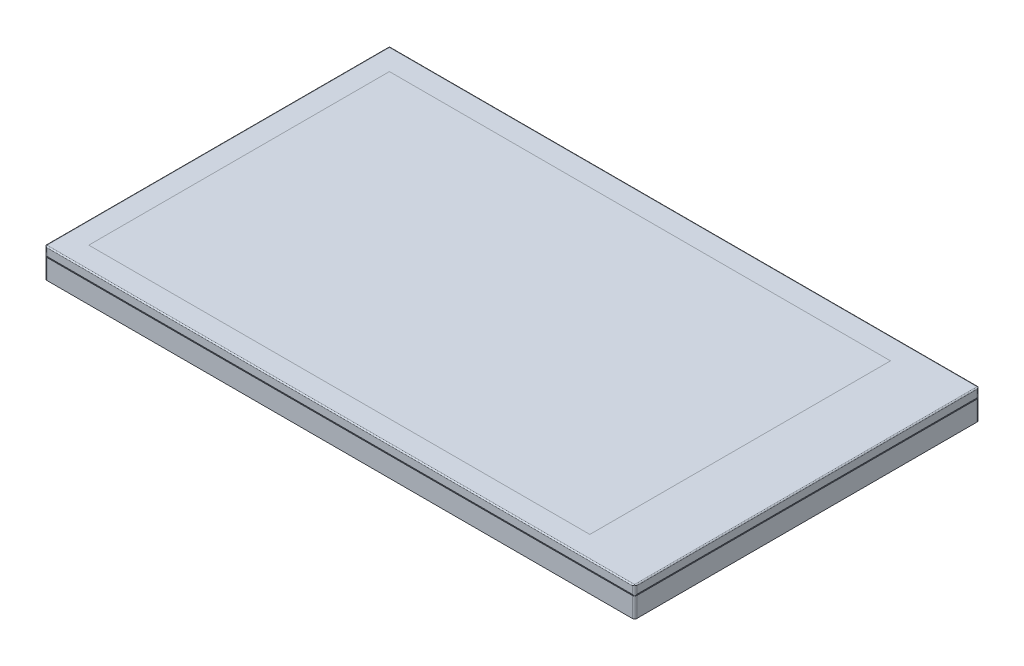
SolidWorks part; units mm, degrees
ref_plane "Front Plane" through (0, 0, 0) normal (0, 0, 1) x (1, 0, 0)
ref_plane "Top Plane" through (0, 0, 0) normal (0, 1, 0) x (1, 0, 0)
ref_plane "Right Plane" through (0, 0, 0) normal (1, 0, 0) x (0, 0, -1)
sketch "Sketch1" plane through (0, 0, 0) normal (0, 1, 0) x (1, 0, 0)
  line L1 (-38.5, -22.5) -> (38.5, -22.5)
  line L2 (-38.5, -22.5) -> (-38.5, 22.5)
  line L3 (-38.5, 22.5) -> (38.5, 22.5)
  line L4 (38.5, -22.5) -> (38.5, 22.5)
  line L5 (-38.5, -22.5) -> (38.5, 22.5) construction
  line L6 (-38.5, 22.5) -> (38.5, -22.5) construction
  point P0 (0, 0)
  dimension "D1" = 77
  dimension "D2" = 45
extrude "Screen Base" add sketch "Sketch1" along normal blind 3.85
ref_plane "TFT Plane" through (0, 1.5, 0) normal (0, 1, 0) x (1, 0, 0)
ref_plane "Touch Plane" through (0, 2.6, 0) normal (0, 1, 0) x (1, 0, 0)
sketch "Sketch5" plane through (0, 2.6, 0) normal (0, 1, 0) x (1, 0, 0)
  line L4 (38.5, -22.5) -> (38.5, 22.5)
  line L5 (38.5, 22.5) -> (-38.5, 22.5)
  line L6 (-38.5, 22.5) -> (-38.5, -22.5)
  line L7 (-38.5, -22.5) -> (38.5, -22.5)
  line L8 (38.5, -22.5) -> (38.5, 22.5)
  line L9 (38.5, 22.5) -> (-38.5, 22.5)
  line L10 (-38.5, 22.5) -> (-38.5, -22.5)
  line L11 (-38.5, -22.5) -> (38.5, -22.5)
  dimension "D1" = 0
sketch "Sketch6" plane through (0, 0, 0) normal (0, 0, 1) x (1, 0, 0)
  line L0 (-38.5, 3.85) -> (-38.5, 3.7)
  line L1 (38.35, 2.6) -> (38.5, 2.6)
  line L2 (38.5, 3.85) -> (38.5, 0) construction
  line L3 (-38.5, 3.85) -> (-38.35, 3.85)
  line L4 (-38.5, 3.85) -> (38.5, 3.85) construction
  line L5 (-38.5, 3.85) -> (-38.5, 0) construction
  line L6 (-38.5, 2.6) -> (-38.5, 2.75)
  line L7 (-38.5, 2.6) -> (38.5, 2.6) construction
  line L8 (-38.5, 2.6) -> (-38.35, 2.6)
  line L9 (38.5, 3.7) -> (38.5, 3.85)
  line L10 (38.5, 2.6) -> (38.5, 2.75)
  line L11 (38.5, 3.85) -> (38.35, 3.85)
  line L12 (38.5, 3.85) -> (-38.5, 3.85) construction
  arc A0 (-38.5, 3.7) -> (-38.35, 3.85) centre (-38.35, 3.7) cw
  arc A1 (-38.35, 2.6) -> (-38.5, 2.75) centre (-38.35, 2.75) cw
  arc A2 (38.35, 3.85) -> (38.5, 3.7) centre (38.35, 3.7) cw
  arc A3 (38.35, 2.6) -> (38.5, 2.75) centre (38.35, 2.75) ccw
  dimension "D1" = 0.15
  dimension "D2" = 0.15
  dimension "D3" = 0.15
  dimension "D4" = 0.15
sketch "TFT AA" plane through (0, 3.85, 0) normal (0, 1, 0) x (1, 0, 0)
  line L0 (-35.62, 0) -> (29.78, 0) construction
  line L1 (-35.62, 19.62) -> (29.78, 19.62)
  line L2 (-35.62, 19.62) -> (-35.62, -19.62)
  line L3 (-35.62, -19.62) -> (29.78, -19.62)
  line L4 (29.78, 19.62) -> (29.78, -19.62)
  line L6 (-38.5, 22.5) -> (-38.5, -22.5) construction
  dimension "D1" = 65.4
  dimension "D2" = 39.24
  dimension "D3" = 2.88
sketch "CTP Cover VA" plane through (0, 3.85, 0) normal (0, 1, 0) x (1, 0, 0)
  line L1 (30.08, -19.77) -> (-35.92, -19.77)
  line L2 (30.08, -19.77) -> (30.08, 19.77)
  line L3 (30.08, 19.77) -> (-35.92, 19.77)
  line L4 (-35.92, -19.77) -> (-35.92, 19.77)
  line L5 (-2.92, 19.77) -> (-2.92, 19.62)
  line L7 (-35.92, 0) -> (-38.5, 0) construction
  line L8 (-38.5, 22.5) -> (-38.5, -22.5) construction
  line L9 (-35.62, 19.62) -> (29.78, 19.62) construction
  dimension "D1" = 66
  dimension "D2" = 39.54
sketch "CTP Cover OD" plane through (0, 3.85, 0) normal (0, 1, 0) x (1, 0, 0)
  line L0 (0, -22.42) -> (0, -22.5) construction
  line L1 (38.4, -22.42) -> (-38.4, -22.42)
  line L2 (38.4, -22.42) -> (38.4, 22.42)
  line L3 (38.4, 22.42) -> (-38.4, 22.42)
  line L4 (-38.4, -22.42) -> (-38.4, 22.42)
  line L5 (-38.5, -22.5) -> (38.5, -22.5) construction
  line L6 (-38.4, 0) -> (-38.5, 0) construction
  dimension "D1" = 76.8
  dimension "D2" = 44.84
fillet "Edge Fillet" radius 0.3 4 edges at (-38.5, 1.925, 22.5) (-38.5, 1.925, -22.5) (38.5, 1.925, 22.5) (38.5, 1.925, -22.5)
extrude "Bezel Fillet One" cut sketch "Sketch6" against normal mid plane 100
sketch "Sketch17" plane through (-38.5, 0, 0) normal (-1, 0, 0) x (0, 0, 1)
  line L0 (22.35, 2.6) -> (22.5, 2.6)
  line L1 (22.5, 2.6) -> (22.5, 2.75)
  line L2 (22.5, 3.85) -> (22.35, 3.85)
  line L3 (22.5, 3.7) -> (22.5, 3.85)
  line L5 (22.4598, 3.85) -> (-22.4598, 3.85) construction
  line L6 (-22.5, 2.6) -> (22.5, 2.6) construction
  line L7 (-22.5, 2.75) -> (-22.5, 2.6)
  line L8 (22.5, 2.6) -> (-22.5, 2.6) construction
  line L9 (-22.5, 2.6) -> (-22.35, 2.6)
  line L10 (-22.5, 3.85) -> (-22.35, 3.85)
  line L11 (22.42, 3.85) -> (-22.42, 3.85) construction
  line L12 (-22.5, 3.85) -> (-22.5, 3.7)
  line L13 (-22.4598, 3.85) -> (22.4598, 3.85) construction
  line L14 (22.5, 3.85) -> (22.5, 0) construction
  line L15 (-22.5, 0) -> (-22.5, 3.85) construction
  arc A0 (22.35, 3.85) -> (22.5, 3.7) centre (22.35, 3.7) cw
  arc A1 (22.35, 2.6) -> (22.5, 2.75) centre (22.35, 2.75) ccw
  arc A2 (-22.5, 2.75) -> (-22.35, 2.6) centre (-22.35, 2.75) ccw
  arc A3 (-22.35, 3.85) -> (-22.5, 3.7) centre (-22.35, 3.7) ccw
  dimension "D1" = 0.15
  dimension "D2" = 0.15
  dimension "D3" = 0.15
  dimension "D4" = 0.15
  dimension "D5" = 0.15
  dimension "D6" = 0.15
extrude "Bezel Fillet Two" cut sketch "Sketch17" against normal blind 100
sketch "Sketch18" plane through (0, 1.5, 0) normal (0, 1, 0) x (1, 0, 0)
  line L0 (38.5, -10.98) -> (38.5, 12.02)
  line L1 (38.5, -22.2) -> (38.5, 22.2) construction
  line L2 (-38.2, -22.5) -> (38.2, -22.5) construction
  dimension "D1" = 11.52
  dimension "D2" = 23
ref_plane "Plane1" through (0, 2.97, 0) normal (0, 1, 0) x (1, 0, 0)
sketch "Sketch20" plane through (0, 2.97, 0) normal (0, 1, 0) x (1, 0, 0)
  line L0 (38.5, -18.9) -> (38.5, 2.6)
  line L1 (38.5, -22.2) -> (38.5, 22.2) construction
  dimension "D1" = 3.6
  dimension "D2" = 21.5
